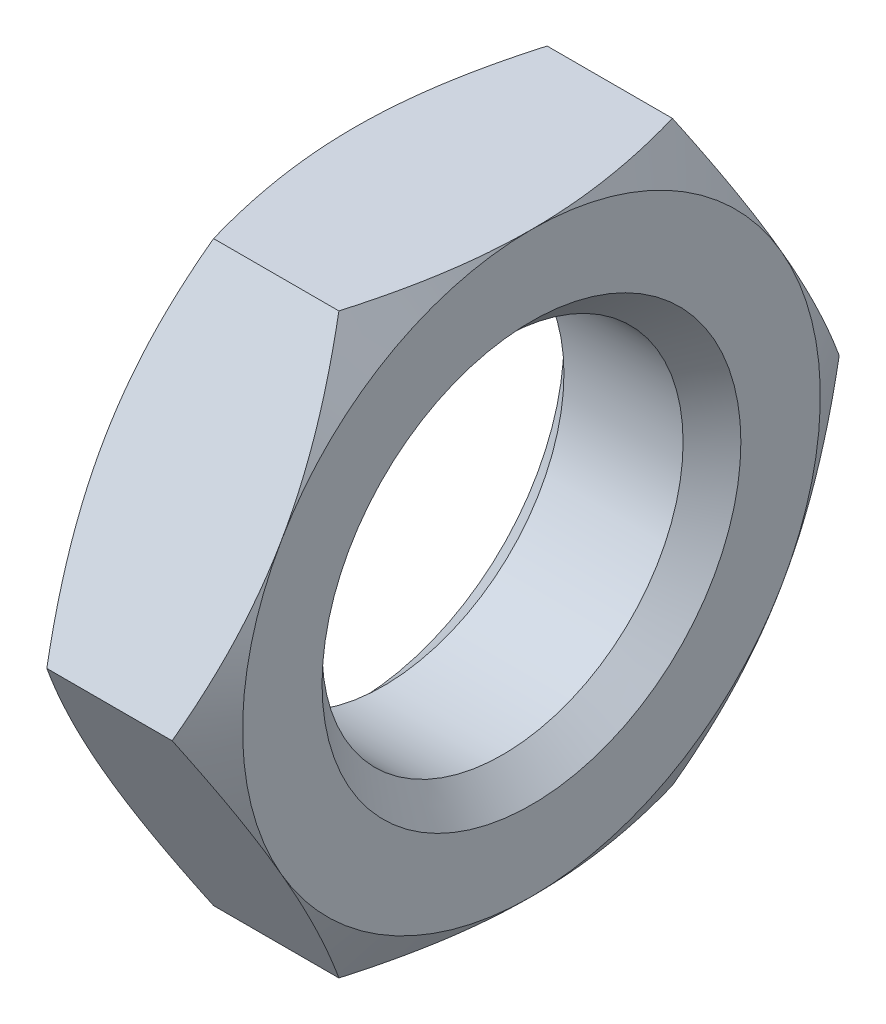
SolidWorks part; units mm, degrees
ref_plane "Front Plane" through (0, 0, 0) normal (0, 0, 1) x (1, 0, 0)
ref_plane "Top Plane" through (0, 0, 0) normal (0, 1, 0) x (1, 0, 0)
ref_plane "Right Plane" through (0, 0, 0) normal (1, 0, 0) x (0, 0, -1)
sketch "Sketch1" plane through (0, 0, 0) normal (1, 0, 0) x (0, 0, -1)
  line L1 (2.3094, 4) -> (-2.3094, 4)
  line L2 (-2.3094, 4) -> (-4.6188, 0)
  line L3 (-4.6188, 0) -> (-2.3094, -4)
  line L4 (-2.3094, -4) -> (2.3094, -4)
  line L5 (2.3094, -4) -> (4.6188, 0)
  line L6 (4.6188, 0) -> (2.3094, 4)
  circle A0 centre (0, 0) radius 4 construction
  circle A1 centre (0, 0) radius 2.5
extrude "Extrude1" add sketch "Sketch1" along normal blind 2.45
sketch "Sketch2" plane through (0, 0, 0) normal (0, 0, 1) x (1, 0, 0)
  line L0 (2.45, 4) -> (2.45, 16)
  line L1 (2.45, 16) -> (0, 16)
  line L2 (0, 16) -> (0, 4)
  line L3 (0, 4) -> (1.225, 6.1218)
  line L4 (1.225, 6.1218) -> (2.45, 4)
revolve "Cut-Revolve1" cut sketch "Sketch2" angle 360 about axis through (2.45, 0, 0) along (-1, 0, 0)
chamfer "Chamfer1" distance 0.4 angle 45 2 edges at (0, 0, -2.5) (2.45, 0, -2.5)
equation "\"D2@Sketch2\"=\"D1@Sketch1\"*2"
